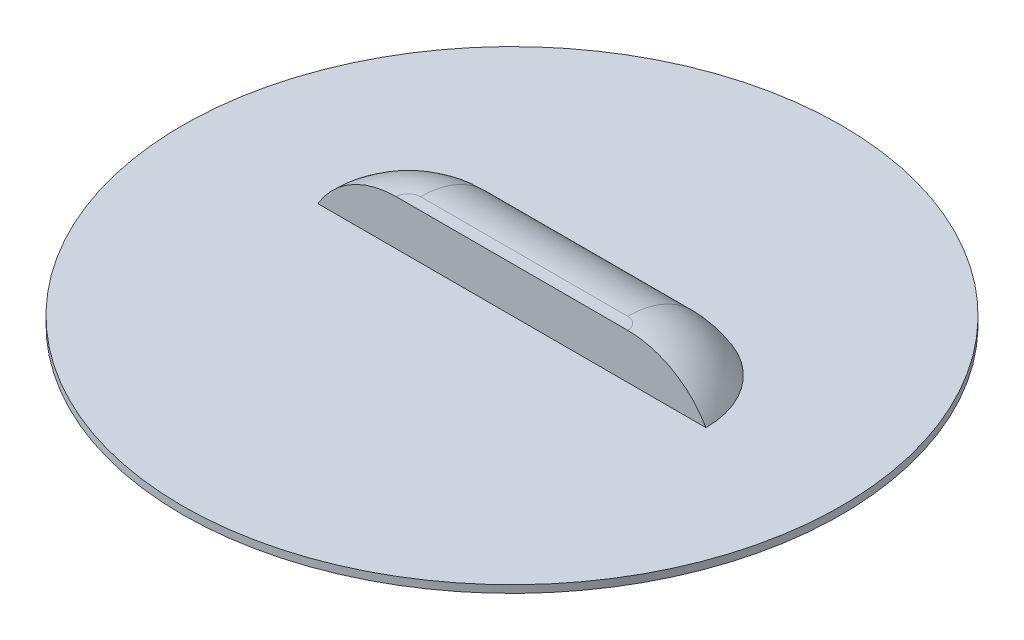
SolidWorks part; units mm, degrees
ref_plane "Front Plane" through (0, 0, 0) normal (0, 0, 1) x (1, 0, 0)
ref_plane "Top Plane" through (0, 0, 0) normal (0, 1, 0) x (1, 0, 0)
ref_plane "Right Plane" through (0, 0, 0) normal (1, 0, 0) x (0, 0, -1)
sketch "Sketch1" plane through (0, 0, 0) normal (0, 1, 0) x (1, 0, 0)
  line L1 (-50.8, 38.1) -> (50.8, 38.1)
  line L2 (-50.8, 38.1) -> (-50.8, -38.1)
  line L3 (-50.8, -38.1) -> (50.8, -38.1)
  line L4 (50.8, 38.1) -> (50.8, -38.1)
  line L5 (-50.8, 38.1) -> (50.8, -38.1) construction
  line L6 (-50.8, -38.1) -> (50.8, 38.1) construction
  point P0 (0, 0)
  dimension "D1" = 76.2
  dimension "D2" = 101.6
extrude "Extrude1" add sketch "Sketch1" along normal blind 1.016
sketch "Sketch2" plane through (0, 1.016, 0) normal (0, 1, 0) x (-1, 0, 0)
  line L0 (26.1662, 0.0053) -> (-26.162, 0.0053)
  line L10 (13.9689, -12.192) -> (-13.9647, -12.192)
  line L12 (50.8, 0.0053) -> (-50.8, 0.0053) construction
  line L14 (50.8, -12.192) -> (-50.8, -12.192) construction
  arc A0 (-26.162, 0.0053) -> (-13.9647, -12.192) centre (-13.9647, 0.0053) ccw
  arc A1 (26.1662, 0.0053) -> (13.9689, -12.192) centre (13.9689, 0.0053) cw
extrude "Extrude2" add sketch "Sketch2" along normal blind 6.096
fillet "Fillet1" radius 12.192 3 edges at (22.5895, 7.112, -8.6195) (-0.0021, 7.112, -12.192) (-22.5937, 7.112, -8.6195)
sketch "Sketch3" plane through (0, 1.016, 0) normal (0, 1, 0) x (1, 0, 0)
  line L0 (13.9647, 12.192) -> (-13.9689, 12.192) construction
  line L1 (13.9647, 12.192) -> (-13.9689, 12.192)
  line L2 (-26.1662, -0.0053) -> (26.162, -0.0053) construction
  line L3 (-26.1662, -0.0053) -> (26.162, -0.0053)
  line L4 (50.8, -38.1) -> (50.8, 38.1)
  line L5 (50.8, 38.1) -> (-50.8, 38.1)
  line L6 (-50.8, 38.1) -> (-50.8, -38.1)
  line L7 (-50.8, -38.1) -> (50.8, -38.1)
  line L8 (50.8, -38.1) -> (50.8, 38.1)
  line L9 (50.8, 38.1) -> (-50.8, 38.1)
  line L10 (-50.8, 38.1) -> (-50.8, -38.1)
  line L11 (-50.8, -38.1) -> (50.8, -38.1)
  arc A0 (-13.9689, 12.192) -> (-26.1662, -0.0053) centre (-13.9689, -0.0053) ccw construction
  arc A1 (-13.9689, 12.192) -> (-26.1662, -0.0053) centre (-13.9689, -0.0053) ccw
  arc A2 (26.162, -0.0053) -> (13.9647, 12.192) centre (13.9647, -0.0053) ccw construction
  arc A3 (26.162, -0.0053) -> (13.9647, 12.192) centre (13.9647, -0.0053) ccw
  dimension "D1" = 0
extrude "Cut-Extrude1" cut sketch "Sketch3" against normal through all
sketch "Sketch4" plane through (0, 0, 0) normal (0, -1, 0) x (1, 0, 0)
  circle A0 centre (0, 0) radius 44.45
  dimension "D1" = 88.9
extrude "Boss-Extrude1" add sketch "Sketch4" against normal up to vertex
